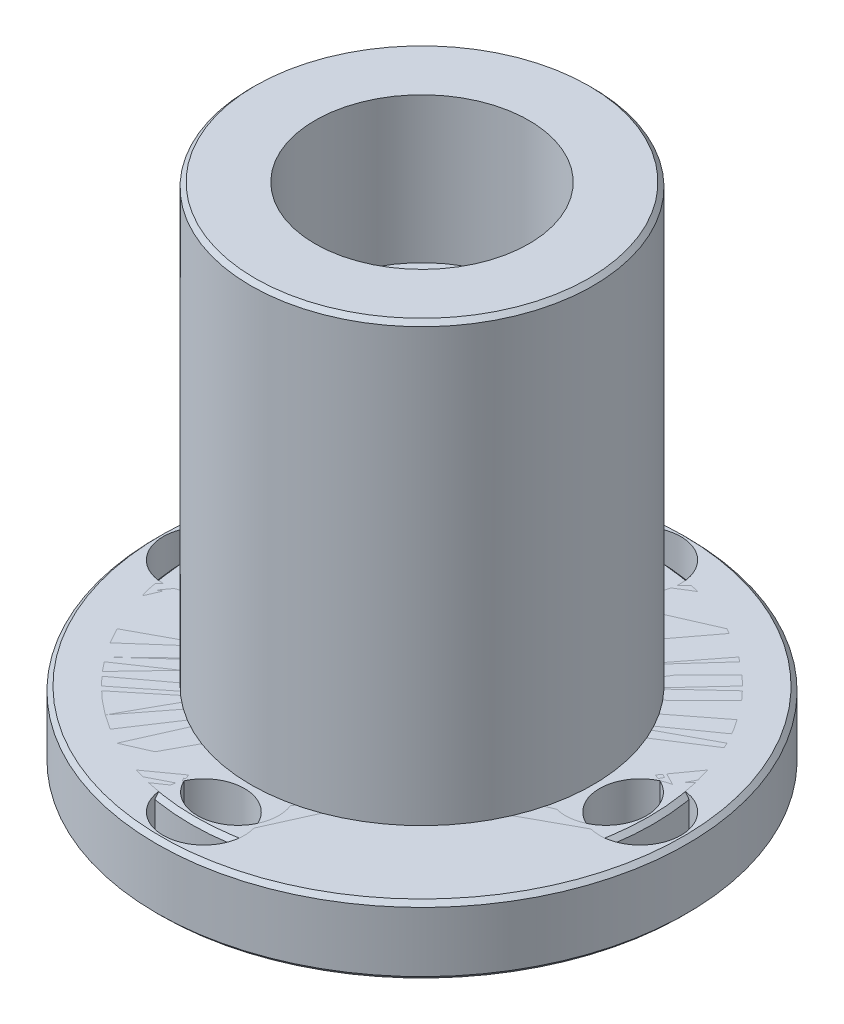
SolidWorks part; units mm, degrees
other "Solid1"
ref_plane "Front Plane" through (0, 0, 0) normal (0, 0, 1) x (1, 0, 0)
ref_plane "Top Plane" through (0, 0, 0) normal (0, 1, 0) x (1, 0, 0)
ref_plane "Right Plane" through (0, 0, 0) normal (1, 0, 0) x (0, 0, -1)
imported_body "2.7036 LMF20.stp<1>"
sketch "Sketch1" plane through (0, 42, 0) normal (0, 1, 0) x (1, 0, 0)
  circle A0 centre (0, 0) radius 12.0985
  circle A1 centre (0, 0) radius 20
  dimension "D1" = 40
extrude "Boss-Extrude1" add sketch "Sketch1" against normal up to surface (34 mm away)
sketch "Sketch3" plane through (0, 0, 0) normal (0, -1, 0) x (1, 0, 0)
  circle A0 centre (0, 0) radius 31
  circle A1 centre (0, 0) radius 16.9196
  dimension "D1" = 62
extrude "Boss-Extrude5" add sketch "Sketch3" against normal up to surface (8 mm away)
chamfer "Chamfer1" distance 0.5 angle 45 2 edges at (0, 0, -31) (0, 8, -31)
sketch "Sketch4" plane through (0, 42, 0) normal (0, 1, 0) x (1, 0, 0)
  circle A0 centre (0, 0) radius 12.5
  dimension "D1" = 25
extrude "Cut-Extrude1" cut sketch "Sketch4" against normal through all
sketch "Sketch5" plane through (0, 42, 0) normal (0, 1, 0) x (1, 0, 0)
  circle A0 centre (0, 0) radius 12.5 construction
  circle A1 centre (0, 0) radius 20
  circle A2 centre (0, 0) radius 20
  circle A3 centre (0, 0) radius 12.5
  dimension "D1" = 0
extrude "Boss-Extrude6" add sketch "Sketch5" along normal blind 17
chamfer "Chamfer2" distance 0.5 angle 45 1 edges at (0, 59, 20)
sketch "Sketch7" plane through (0, 8, 0) normal (0, 1, 0) x (1, 0, 0)
  point P3 (0, 25.5)
  point P4 (25.5, 0)
  point P5 (0, -25.5)
  point P6 (-25.5, 0)
hole_wizard "CBORE for M5 Hex Head Bolt1" positions "Sketch7" profile "Sketch8" counterbore size "M5" standard "DIN"
sketch "Sketch8" plane through (0, 8, -25.5) normal (1, 0, 0) x (0, 0, 1)
  line L0 (0, 0) -> (0, 8)
  line L1 (0, 8) -> (2.75, 8)
  line L3 (2.75, 8) -> (2.75, 5.4)
  line L4 (2.75, 5.4) -> (4.75, 5.4)
  line L5 (4.75, 5.4) -> (4.75, 0)
  line L7 (4.75, 0) -> (0, 0)
  line L11 (0, -6.35) -> (0, 107.95) construction
  dimension "Thru Hole Dia." = 5.5
  dimension "Thru Hole Depth" = 8
  dimension "C'Bore Dia." = 9.5
  dimension "C'Bore Depth" = 5.4
